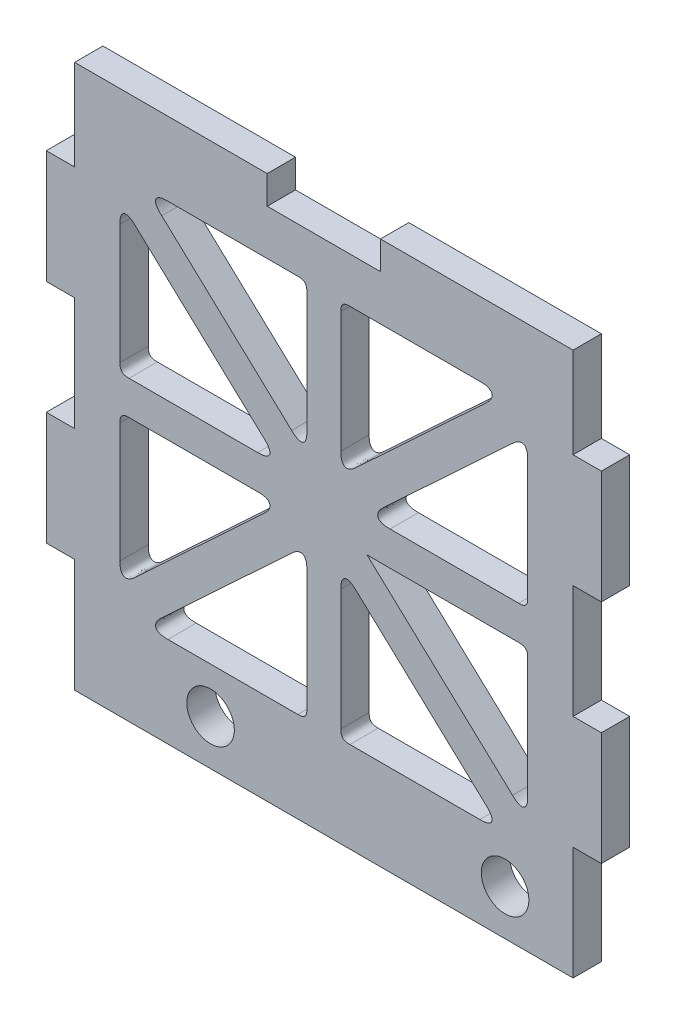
SolidWorks part; units mm, degrees
ref_plane "前视基准面" through (0, 0, 0) normal (0, 0, 1) x (1, 0, 0)
ref_plane "上视基准面" through (0, 0, 0) normal (0, 1, 0) x (1, 0, 0)
ref_plane "右视基准面" through (0, 0, 0) normal (1, 0, 0) x (0, 0, -1)
sketch "草图1" plane through (0, 0, 0) normal (0, 0, 1) x (1, 0, 0)
  line L1 (-22, 0) -> (22, 0)
  line L2 (-22, 0) -> (-22, 48)
  line L3 (-22, 48) -> (22, 48)
  line L4 (22, 0) -> (22, 48)
  dimension "D1" = 44
  dimension "D2" = 48
extrude "凸台-拉伸1" add sketch "草图1" along normal blind 2.5
sketch "草图2" plane through (0, 0, 2.5) normal (0, 0, 1) x (1, 0, 0)
  line L0 (0, 0) -> (0, 61.7262) construction
  line L1 (-22, 0) -> (22, 0) construction
  line L2 (22, 0) -> (22, 48) construction
  line L3 (22, 20) -> (24.5, 20)
  line L4 (22, 20) -> (22, 10)
  line L5 (22, 10) -> (24.5, 10)
  line L6 (24.5, 20) -> (24.5, 10)
  line L7 (-24.5, 40) -> (-24.5, 30)
  line L8 (22, 40) -> (24.5, 40)
  line L9 (22, 40) -> (22, 30)
  line L10 (22, 30) -> (24.5, 30)
  line L11 (24.5, 40) -> (24.5, 30)
  line L12 (-22, 30) -> (-24.5, 30)
  line L13 (-22, 40) -> (-22, 30)
  line L14 (-22, 40) -> (-24.5, 40)
  line L15 (-24.5, 20) -> (-24.5, 10)
  line L16 (-22, 10) -> (-24.5, 10)
  line L17 (-22, 20) -> (-22, 10)
  line L18 (-22, 20) -> (-24.5, 20)
  dimension "D1" = 2.5
  dimension "D2" = 10
  dimension "D3" = 10
  dimension "D4" = 10
  dimension "D5" = 10
extrude "凸台-拉伸2" add sketch "草图2" against normal up to surface (2.5 mm away)
sketch "草图3" plane through (0, 0, 2.5) normal (0, 0, 1) x (1, 0, 0)
  line L1 (-22, 0) -> (22, 0) construction
  line L2 (22, 0) -> (22, 10) construction
  circle A0 centre (-10, 4) radius 2.1
  circle A1 centre (16, 4) radius 2.1
  dimension "D4" = 4.2
  dimension "D1" = 6
  dimension "D2" = 26
  dimension "D3" = 4
extrude "切除-拉伸1" cut sketch "草图3" against normal up to surface (2.5 mm away)
sketch "草图4" plane through (0, 0, 2.5) normal (0, 0, 1) x (1, 0, 0)
  line L0 (0, 48) -> (0, 48.0519) construction
  line L1 (22, 48) -> (-22, 48) construction
  line L3 (-5, 48) -> (5, 48)
  line L4 (-5, 48) -> (-5, 45.5)
  line L5 (-5, 45.5) -> (5, 45.5)
  line L6 (5, 48) -> (5, 45.5)
  dimension "D1" = 10
  dimension "D2" = 2.5
extrude "切除-拉伸2" cut sketch "草图4" against normal up to surface (2.5 mm away)
sketch "草图5" plane through (0, 0, 2.5) normal (0, 0, 1) x (1, 0, 0)
  line L0 (0, 0) -> (0, 45.5) construction
  line L1 (-22, 0) -> (22, 0) construction
  line L2 (-5, 45.5) -> (5, 45.5) construction
  line L3 (22, 20) -> (22, 30) construction
  line L4 (-18, 41.5) -> (18, 41.5) construction
  line L5 (-18, 41.5) -> (-18, 8) construction
  line L6 (-18, 8) -> (18, 8) construction
  line L7 (18, 41.5) -> (18, 8) construction
  line L8 (-18, 24.75) -> (18, 24.75) construction
  line L9 (-18, 41.5) -> (18, 8) construction
  line L10 (-18, 8) -> (18, 41.5) construction
  line L11 (-18, 39.451) -> (-18, 26.25)
  line L12 (-18, 26.25) -> (-3.8138, 26.25)
  line L13 (-3.8138, 26.25) -> (-18, 39.451)
  line L14 (-3.8138, 23.25) -> (-18, 10.049)
  line L15 (-18, 23.25) -> (-3.8138, 23.25)
  line L16 (-18, 10.049) -> (-18, 23.25)
  line L17 (18, 10.049) -> (18, 23.25)
  line L18 (18, 23.25) -> (3.8138, 23.25)
  line L19 (3.8138, 23.25) -> (18, 10.049)
  line L20 (3.8138, 26.25) -> (18, 39.451)
  line L21 (18, 26.25) -> (3.8138, 26.25)
  line L22 (18, 39.451) -> (18, 26.25)
  line L23 (-15.7981, 41.5) -> (-1.5, 41.5)
  line L24 (-1.5, 41.5) -> (-1.5, 28.1948)
  line L25 (-1.5, 28.1948) -> (-15.7981, 41.5)
  line L26 (1.5, 41.5) -> (1.5, 28.1948)
  line L27 (15.7981, 41.5) -> (1.5, 41.5)
  line L28 (1.5, 28.1948) -> (15.7981, 41.5)
  line L29 (1.5, 21.3052) -> (15.7981, 8)
  line L30 (15.7981, 8) -> (1.5, 8)
  line L31 (1.5, 8) -> (1.5, 21.3052)
  line L32 (-1.5, 21.3052) -> (-15.7981, 8)
  line L33 (-1.5, 8) -> (-1.5, 21.3052)
  line L34 (-15.7981, 8) -> (-1.5, 8)
  dimension "D1" = 4
  dimension "D2" = 4
  dimension "D3" = 8
  dimension "D4" = 1.5
  dimension "D5" = 1.5
  dimension "D6" = 1.5
  dimension "D7" = 1.5
extrude "切除-拉伸3" cut sketch "草图5" against normal up to surface (2.5 mm away)
fillet "圆角1" radius 0.8 23 edges at (1.5, 41.5, 1.25) (15.7981, 41.5, 1.25) (18, 39.451, 1.25) (18, 26.25, 1.25) (3.8138, 26.25, 1.25) (1.5, 28.1948, 1.25) (18, 23.25, 1.25) (18, 10.049, 1.25) (15.7981, 8, 1.25) (1.5, 21.3052, 1.25) (1.5, 8, 1.25) (-1.5, 8, 1.25) (-1.5, 21.3052, 1.25) (-15.7981, 8, 1.25) (-18, 10.049, 1.25) (-3.8138, 23.25, 1.25) (-18, 23.25, 1.25) (-18, 26.25, 1.25) (-3.8138, 26.25, 1.25) (-1.5, 28.1948, 1.25) (-1.5, 41.5, 1.25) (-15.7981, 41.5, 1.25) (-18, 39.451, 1.25)
